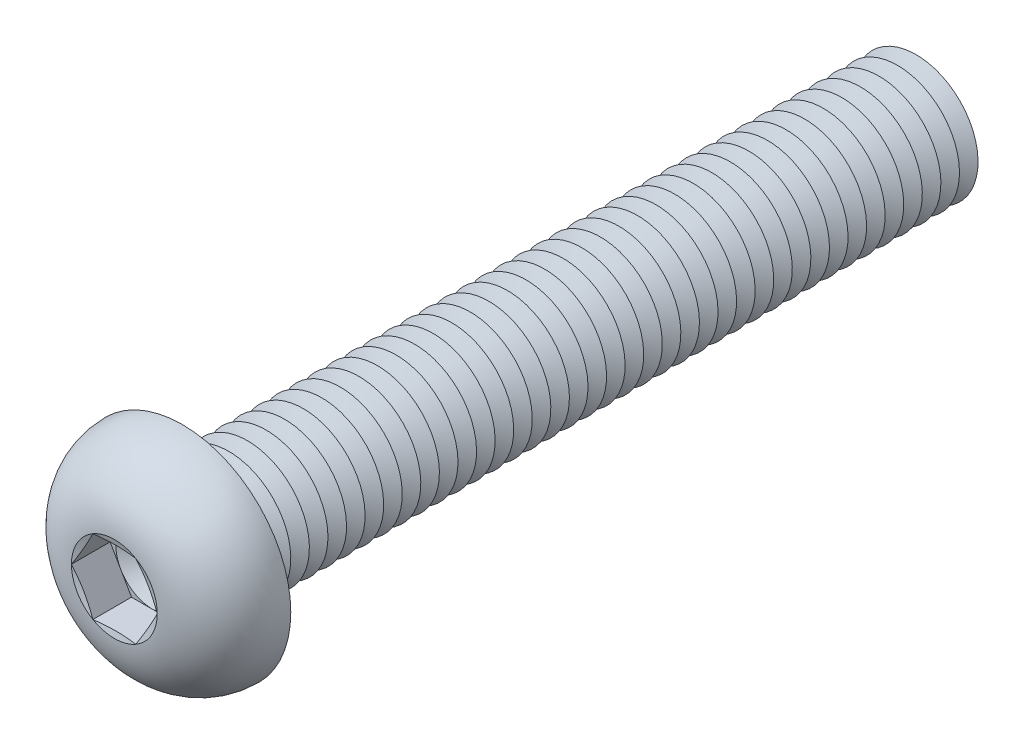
SolidWorks part; units mm, degrees
ref_plane "Front Plane" through (0, 0, 0) normal (0, 0, 1) x (1, 0, 0)
ref_plane "Top Plane" through (0, 0, 0) normal (0, 1, 0) x (1, 0, 0)
ref_plane "Right Plane" through (0, 0, 0) normal (1, 0, 0) x (0, 0, -1)
sketch "Sketch1" plane through (0, 0, 0) normal (1, 0, 0) x (0, 0, -1)
  line L0 (0, 5) -> (0, 8.75)
  line L3 (0, 5) -> (60, 5)
  line L4 (60, 5) -> (60, 0)
  line L5 (60, 0) -> (-5.5, 0) construction
  line L6 (-5.5, 0) -> (60, 0)
  line L7 (-5.5, 3.4641) -> (-5.5, 1.732) construction
  line L8 (-5.5, 1.732) -> (-5.5, 0)
  line L9 (-5.5, 3.4641) -> (-5.0359, 1.732)
  line L10 (-5.0359, 1.732) -> (-5.5, 1.732)
  line L11 (60, 0) -> (22.7481, 0) construction
  line L12 (0, 8.75) -> (-5.5, 8.75) construction
  arc A1 (0, 8.75) -> (-5.5, 3.4641) centre (0, 3.2457) ccw
  point P8 (60, 2.5)
  dimension "D1" = 17.5
  dimension "D2" = 10
  dimension "D3" = 5.5
  dimension "D4" = 6.9282
  dimension "D5" = 60
  dimension "D6" = 15
revolve "Revolve1" add sketch "Sketch1" angle 360 about L5
fillet "Fillet1" radius 0.75 1 edges at (0, 5, 0)
sketch "Sketch2" plane through (0, 0, 0) normal (1, 0, 0) x (0, 0, -1)
  line L0 (59.25, 5) -> (60.75, 5)
  line L1 (60, 5) -> (0.75, 5) construction
  line L2 (60.75, 5) -> (60, 3.701)
  line L3 (60, -5) -> (60, 5) construction
  line L4 (60, 3.701) -> (59.25, 5)
  dimension "D1" = 1.5
revolve "Cut-Revolve1" cut sketch "Sketch2" angle 360 about axis through (0, 0, -60) along (0, 0, -1)
pattern_linear "LPattern1" count 40 spacing 1.5 along (0, 0, 1) of "Cut-Revolve1"
sketch "Sketch3" plane through (0, 0, 5.5) normal (0, 0, 1) x (1, 0, 0)
  line L7 (1.732, 3) -> (-1.7321, 3)
  line L8 (-1.7321, 3) -> (-3.4641, 0)
  line L9 (-3.4641, 0) -> (-1.732, -3)
  line L10 (-1.732, -3) -> (1.732, -3)
  line L11 (1.732, -3) -> (3.4641, 0)
  line L12 (3.4641, 0) -> (1.732, 3)
  circle A0 centre (0, 0) radius 3 construction
  circle A3 centre (0, 0) radius 3.4641 construction
extrude "Cut-Extrude1" cut sketch "Sketch3" against normal blind 3.12
sketch "Sketch4" plane through (0, 0, 2.38) normal (0, 0, 1) x (1, 0, 0)
  line L1 (1.732, 3) -> (-1.7321, 3) construction
  circle A0 centre (0, 0) radius 3
extrude "Cut-Extrude2" cut sketch "Sketch4" against normal through all draft 60
